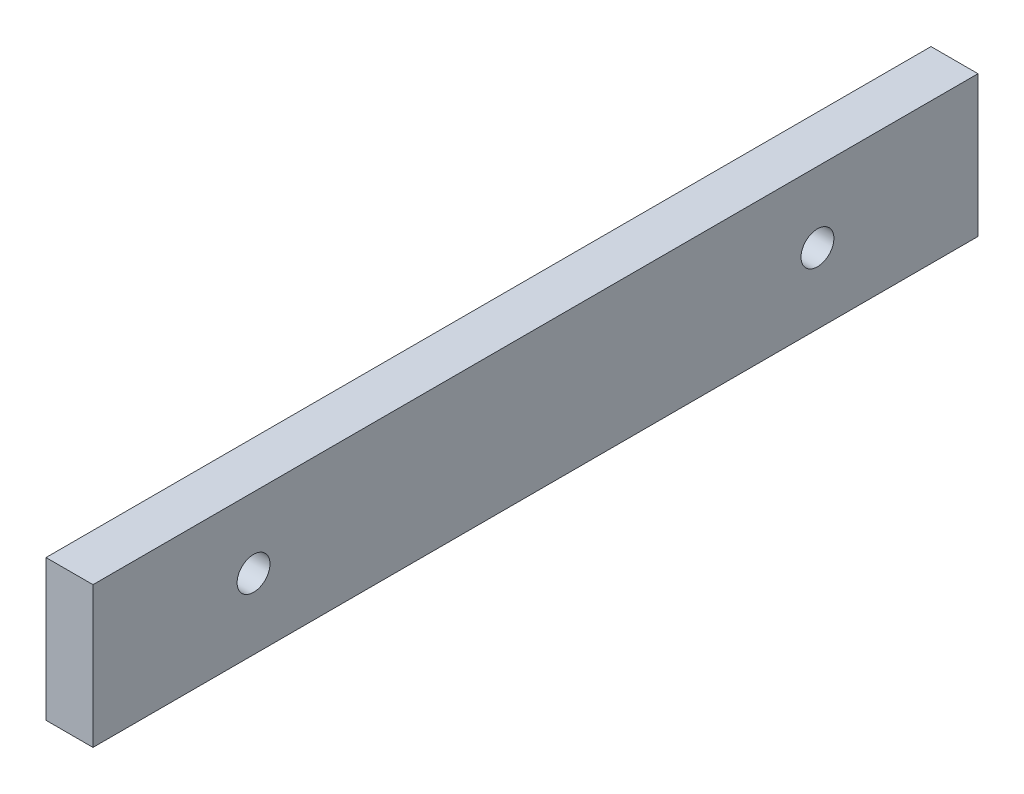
SolidWorks part; units mm, degrees
ref_plane "前视基准面" through (0, 0, 0) normal (0, 0, 1) x (1, 0, 0)
ref_plane "上视基准面" through (0, 0, 0) normal (0, 1, 0) x (1, 0, 0)
ref_plane "右视基准面" through (0, 0, 0) normal (1, 0, 0) x (0, 0, -1)
sketch "草图1" plane through (0, 0, 0) normal (0, 0, 1) x (1, 0, 0)
  line L0 (0, 0) -> (3, 0)
  line L1 (0, 0) -> (0, 9)
  line L2 (3, 0) -> (3, 9)
  line L3 (0, 9) -> (3, 9)
  dimension "D1" = 3
  dimension "D2" = 9
extrude "凸台-拉伸1" add sketch "草图1" along normal blind 56.5 contours L2 L3 L1 L0
sketch "草图2" plane through (0, 0, 0) normal (-1, 0, 0) x (0, 0, 1)
  line L0 (0, 4.5) -> (56.5, 4.5)
  line L4 (0, 9) -> (0, 0)
  line L5 (0, 0) -> (56.5, 0)
  line L6 (56.5, 0) -> (56.5, 9)
  line L7 (56.5, 9) -> (0, 9)
  line L8 (0, 9) -> (0, 0)
  line L9 (0, 0) -> (56.5, 0)
  line L10 (56.5, 0) -> (56.5, 9)
  line L11 (56.5, 9) -> (0, 9)
  circle A0 centre (10.25, 4.5) radius 1.05
  circle A1 centre (46.25, 4.5) radius 1.05
  dimension "D2" = 2.1
  dimension "D3" = 36
  dimension "D4" = 10.25
  dimension "D1" = 0
extrude "切除-拉伸1" cut sketch "草图2" against normal through all contours A0 | A1
